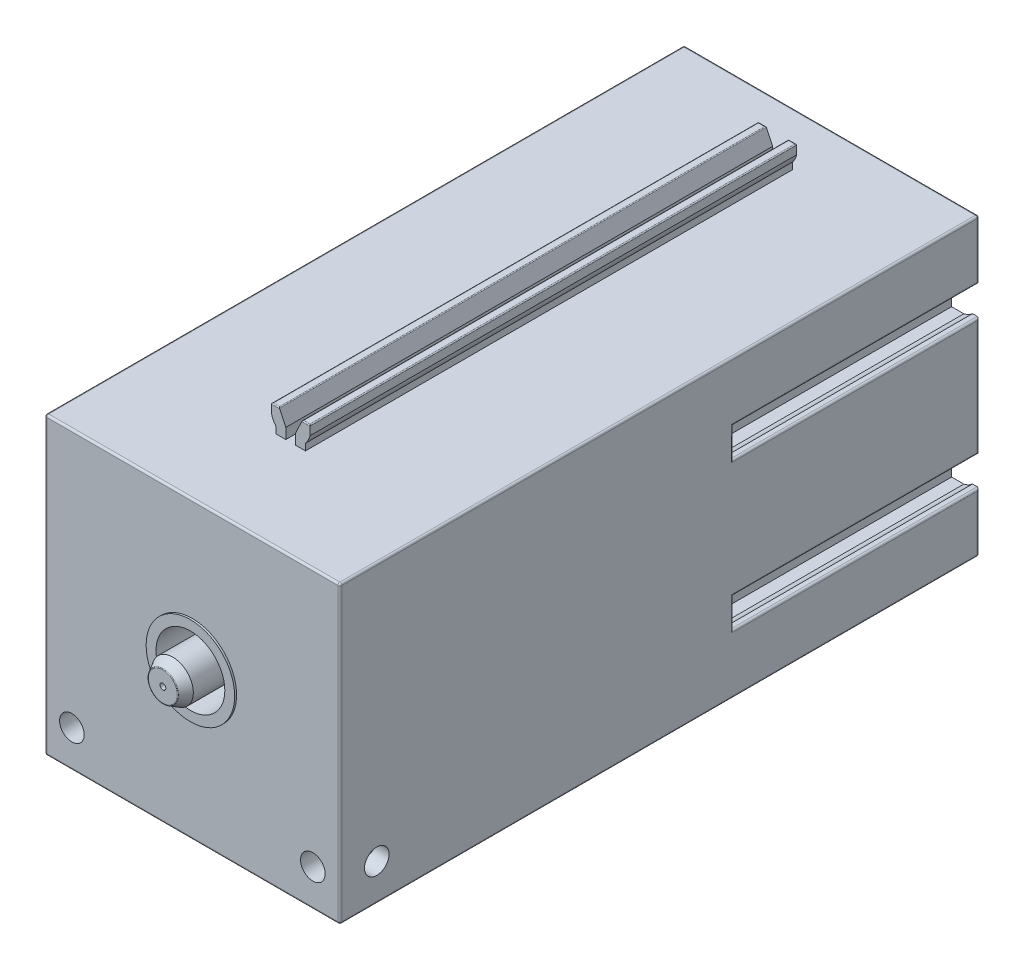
SolidWorks part; units mm, degrees
ref_plane "前视基准面" through (0, 0, 0) normal (0, 0, 1) x (1, 0, 0)
ref_plane "上视基准面" through (0, 0, 0) normal (0, 1, 0) x (1, 0, 0)
ref_plane "右视基准面" through (0, 0, 0) normal (1, 0, 0) x (0, 0, -1)
sketch "草图1" plane through (0, 0, 0) normal (0, 0, 1) x (1, 0, 0)
  line L1 (-15, 0) -> (15, 0)
  line L2 (-15, 0) -> (-15, 30)
  line L3 (-15, 30) -> (15, 30)
  line L4 (15, 0) -> (15, 30)
extrude "凸台-拉伸1" add sketch "草图1" against normal blind 65
sketch "草图2" plane through (0, 0, -65) normal (0, 0, -1) x (-1, 0, 0)
  line L0 (-9, 0.6771) -> (-9, 0)
  line L1 (15, 0) -> (-15, 0) construction
  line L2 (0, -2.0675) -> (0, 3.9748) construction
  line L3 (-6, 0.6771) -> (-6, 0)
  line L4 (-6, 0) -> (-9, 0)
  line L5 (-9.45, 2.8) -> (-5.55, 2.8)
  line L6 (-9.45, 2.8) -> (-9.45, 1.5556)
  line L7 (5.55, 2.8) -> (5.55, 1.5556)
  line L8 (-5.55, 2.8) -> (-5.55, 1.5556)
  line L9 (9.45, 2.8) -> (9.45, 1.5556)
  line L10 (9.45, 2.8) -> (5.55, 2.8)
  line L11 (6, 0) -> (9, 0)
  line L12 (6, 0.6771) -> (6, 0)
  line L13 (9, 0.6771) -> (9, 0)
  arc A0 (9.45, 1.5556) -> (9, 0.6771) centre (7.5, 2) cw
  arc A1 (-6, 0.6771) -> (-5.55, 1.5556) centre (-7.5, 2) ccw
  arc A2 (-9.45, 1.5556) -> (-9, 0.6771) centre (-7.5, 2) ccw
  arc A3 (6, 0.6771) -> (5.55, 1.5556) centre (7.5, 2) cw
extrude "切除-拉伸1" cut sketch "草图2" against normal blind 54
sketch "草图3" plane through (0, 0, -65) normal (0, 0, -1) x (-1, 0, 0)
  line L0 (-14.3229, 9) -> (-15, 9)
  line L1 (-15, 0) -> (-15, 30) construction
  line L2 (-15, 6) -> (-14.3229, 6)
  line L3 (-12.2, 9.45) -> (-12.2, 5.55)
  line L4 (-15, 9) -> (-15, 6)
  line L5 (-12.2, 5.55) -> (-13.4444, 5.55)
  line L6 (-12.2, 9.45) -> (-13.4444, 9.45)
  line L8 (-12.2, 20.55) -> (-13.4444, 20.55)
  line L9 (-12.2, 24.45) -> (-13.4444, 24.45)
  line L10 (-15, 21) -> (-15, 24)
  line L11 (-12.2, 20.55) -> (-12.2, 24.45)
  line L12 (-15, 24) -> (-14.3229, 24)
  line L13 (-14.3229, 21) -> (-15, 21)
  line L15 (14.3229, 21) -> (15, 21)
  line L16 (15, 24) -> (14.3229, 24)
  line L17 (12.2, 20.55) -> (12.2, 24.45)
  line L18 (15, 21) -> (15, 24)
  line L19 (12.2, 24.45) -> (13.4444, 24.45)
  line L20 (12.2, 20.55) -> (13.4444, 20.55)
  line L21 (12.2, 9.45) -> (13.4444, 9.45)
  line L22 (12.2, 5.55) -> (13.4444, 5.55)
  line L23 (15, 9) -> (15, 6)
  line L24 (12.2, 9.45) -> (12.2, 5.55)
  line L25 (15, 6) -> (14.3229, 6)
  line L26 (14.3229, 9) -> (15, 9)
  arc A0 (-14.3229, 6) -> (-13.4444, 5.55) centre (-13, 7.5) ccw
  arc A1 (-13.4444, 9.45) -> (-14.3229, 9) centre (-13, 7.5) ccw
  arc A2 (-13.4444, 20.55) -> (-14.3229, 21) centre (-13, 22.5) cw
  arc A3 (-14.3229, 24) -> (-13.4444, 24.45) centre (-13, 22.5) cw
  arc A4 (14.3229, 24) -> (13.4444, 24.45) centre (13, 22.5) ccw
  arc A5 (13.4444, 20.55) -> (14.3229, 21) centre (13, 22.5) ccw
  arc A6 (13.4444, 9.45) -> (14.3229, 9) centre (13, 7.5) cw
  arc A7 (14.3229, 6) -> (13.4444, 5.55) centre (13, 7.5) cw
extrude "切除-拉伸2" cut sketch "草图3" against normal blind 25
sketch "草图5" plane through (0, 0, -65) normal (0, 0, -1) x (-1, 0, 0)
  line L0 (-1.5, 30.6771) -> (-1.5, 30)
  line L1 (-15, 30) -> (15, 30) construction
  line L2 (1.5, 30) -> (1.5, 30.6771)
  line L3 (-1.95, 32.5) -> (-1.1658, 32.5)
  line L4 (-1.95, 32.5) -> (-1.95, 31.5556)
  line L5 (1.95, 32.5) -> (1.95, 31.5556)
  line L6 (-1.5, 30) -> (-0.5, 30)
  line L7 (-0.5, 30) -> (-0.5, 31.0723)
  line L8 (0.5, 30) -> (0.5, 31.0723)
  line L9 (-0.5, 31.0723) -> (-1.1658, 32.5)
  line L10 (0.5, 31.0723) -> (1.1658, 32.5)
  line L11 (1.1658, 32.5) -> (1.95, 32.5)
  line L12 (0.5, 30) -> (1.5, 30)
  arc A1 (-1.95, 31.5556) -> (-1.5, 30.6771) centre (0, 32) ccw
  arc A2 (1.5, 30.6771) -> (1.95, 31.5556) centre (0, 32) ccw
extrude "凸台-拉伸2" add sketch "草图5" against normal blind 49.5 from offset 5.5
fillet "圆角1" radius 0.1 8 edges at (-1.1658, 32.5, -34.75) (-1.5579, 32.5, -10) (-1.95, 32.5, -34.75) (-1.5579, 32.5, -59.5) (1.95, 32.5, -34.75) (1.5579, 32.5, -10) (1.1658, 32.5, -34.75) (1.5579, 32.5, -59.5)
sketch "草图6" plane through (0, 0, 0) normal (0, 0, 1) x (1, 0, 0)
  circle A0 centre (0, 15) radius 3.5
extrude "切除-拉伸3" cut sketch "草图6" against normal blind 5
sketch "草图7" plane through (0, 0, 0) normal (0, 0, 1) x (1, 0, 0)
  circle A0 centre (0, 15) radius 4.5
  circle A1 centre (0, 15) radius 3.5
extrude "凸台-拉伸3" add sketch "草图7" along normal blind 0.2
sketch "草图8" plane through (0, 0, -5) normal (0, 0, 1) x (1, 0, 0)
  circle A0 centre (0, 15) radius 2.1
extrude "凸台-拉伸4" add sketch "草图8" along normal blind 8
sketch "草图9" plane through (0, 0, 3) normal (0, 0, 1) x (1, 0, 0)
  circle A0 centre (0, 15) radius 0.3
extrude "切除-拉伸4" cut sketch "草图9" against normal blind 8
chamfer "倒角1" distance 1 angle 30 1 edges at (2.1, 15, 3)
fillet "圆角2" radius 0.1 1 edges at (1.5226, 15, 3)
fillet "圆角3" radius 0.2 36 edges at (-12, 0, -65) (0, 0, 0) (12, 0, -65) (9, 0, -38) (7.5, 0, -11) (6, 0, -38) (0, 0, -65) (-6, 0, -38) (-7.5, 0, -11) (-9, 0, -38) (-15, 15, -65) (-15, 21, -52.5) (-15, 22.5, -40) (-15, 24, -52.5) (-15, 27, -65) (-15, 30, -32.5) (-15, 15, 0) (-15, 0, -32.5) (-15, 3, -65) (-15, 6, -52.5) (-15, 7.5, -40) (-15, 9, -52.5) (15, 15, -65) (15, 9, -52.5) (15, 7.5, -40) (15, 6, -52.5) (15, 3, -65) (15, 0, -32.5) (15, 15, 0) (15, 30, -32.5) (15, 27, -65) (15, 24, -52.5) (15, 22.5, -40) (15, 21, -52.5) (0, 30, -65) (0, 30, 0)
sketch "草图10" plane through (0, 0, 0) normal (0, 0, 1) x (1, 0, 0)
  circle A0 centre (-12.25, 3.75) radius 1.25
  circle A1 centre (12.25, 3.75) radius 1.25
extrude "切除-拉伸5" cut sketch "草图10" against normal blind 5
sketch "草图11" plane through (15, 0, 0) normal (1, 0, 0) x (0, 0, -1)
  circle A0 centre (3.75, 3.75) radius 1.25
extrude "切除-拉伸6" cut sketch "草图11" against normal blind 5
sketch "草图12" plane through (-15, 0, 0) normal (-1, 0, 0) x (0, 0, 1)
  circle A0 centre (-3.75, 3.75) radius 1.25
extrude "切除-拉伸7" cut sketch "草图12" against normal blind 5
